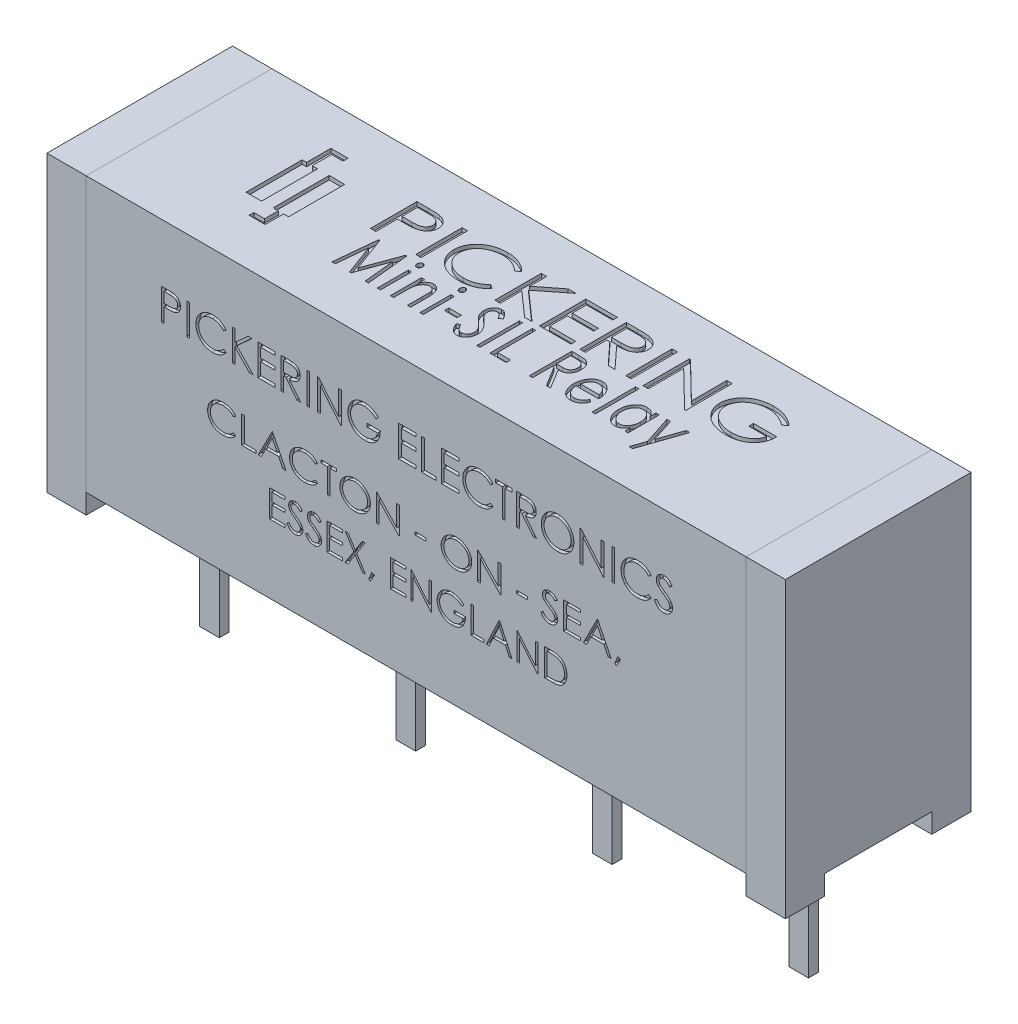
SolidWorks part; units mm, degrees
ref_plane "Front Plane" through (0, 0, 0) normal (0, 0, 1) x (1, 0, 0)
ref_plane "Top Plane" through (0, 0, 0) normal (0, 1, 0) x (1, 0, 0)
ref_plane "Right Plane" through (0, 0, 0) normal (1, 0, 0) x (0, 0, -1)
sketch "Sketch1" plane through (0, 0, 0) normal (0, 1, 0) x (1, 0, 0)
  line L1 (8.534, -2.4) -> (-8.534, -2.4)
  line L2 (8.534, -2.4) -> (8.534, 2.4)
  line L3 (8.534, 2.4) -> (-8.534, 2.4)
  line L4 (-8.534, -2.4) -> (-8.534, 2.4)
  line L5 (8.534, -2.4) -> (-8.534, 2.4) construction
  line L6 (8.534, 2.4) -> (-8.534, -2.4) construction
  point P0 (0, 0)
  dimension "D1" = 4.8
  dimension "D2" = 17.068
extrude "main box" add sketch "Sketch1" along normal blind 7.092
sketch "Sketch2" plane through (-8.534, 0, 0) normal (-1, 0, 0) x (0, 0, 1)
  line L0 (-2.4, 7.092) -> (2.4, 7.092)
  line L1 (2.4, 7.092) -> (2.4, -0.508)
  line L2 (2.4, -0.508) -> (-2.4, -0.508)
  line L3 (-2.4, -0.508) -> (-2.4, 7.092)
  dimension "D1" = 7.6
extrude "end section plus feet" add sketch "Sketch2" along normal blind 1.016 separate body
sketch "Sketch4" plane through (0, 0, 0) normal (0, -1, 0) x (1, 0, 0)
  line L1 (-7.874, -0.127) -> (-7.366, -0.127)
  line L2 (-7.874, -0.127) -> (-7.874, 0.127)
  line L3 (-7.874, 0.127) -> (-7.366, 0.127)
  line L4 (-7.366, -0.127) -> (-7.366, 0.127)
  line L5 (-7.874, -0.127) -> (-7.366, 0.127) construction
  line L6 (-7.874, 0.127) -> (-7.366, -0.127) construction
  line L13 (-2.286, -0.127) -> (-2.794, -0.127)
  line L14 (-2.286, -0.127) -> (-2.286, 0.127)
  line L15 (-2.286, 0.127) -> (-2.794, 0.127)
  line L16 (-2.794, -0.127) -> (-2.794, 0.127)
  line L17 (-2.286, -0.127) -> (-2.794, 0.127) construction
  line L18 (-2.286, 0.127) -> (-2.794, -0.127) construction
  line L19 (-9.55, 2.4) -> (-9.55, -2.4) construction
  line L20 (2.794, -0.127) -> (2.286, -0.127)
  line L21 (2.794, -0.127) -> (2.794, 0.127)
  line L22 (2.794, 0.127) -> (2.286, 0.127)
  line L23 (2.286, -0.127) -> (2.286, 0.127)
  line L24 (2.794, -0.127) -> (2.286, 0.127) construction
  line L25 (2.794, 0.127) -> (2.286, -0.127) construction
  line L26 (7.874, -0.127) -> (7.366, -0.127)
  line L27 (7.874, -0.127) -> (7.874, 0.127)
  line L28 (7.874, 0.127) -> (7.366, 0.127)
  line L29 (7.366, -0.127) -> (7.366, 0.127)
  line L30 (7.874, -0.127) -> (7.366, 0.127) construction
  line L31 (7.874, 0.127) -> (7.366, -0.127) construction
  point P0 (-7.62, 0)
  point P11 (-2.54, 0)
  point P18 (2.54, 0)
  point P23 (7.62, 0)
  dimension "D1" = 0.254
  dimension "D2" = 0.508
  dimension "D3" = 5.08
  dimension "D5" = 0.254
  dimension "D6" = 0.508
  dimension "D7" = 1.93
  dimension "D10" = 5.08
  dimension "D11" = 0.254
  dimension "D12" = 0.508
  dimension "D13" = 0.254
  dimension "D14" = 0.508
  dimension "D15" = 5.08
extrude "Pins" add sketch "Sketch4" along normal blind 3.808
sketch "Sketch6"
  dimension "D1" = 10.15
  dimension "D2" = 9.25
  dimension "D3" = 5.7
  dimension "D4" = 6.05
  dimension "D5" = 2.3
  dimension "D6" = 1.25
extrude "Top writing" cut sketch "Sketch6" against normal blind 0.1
sketch "Sketch7"
  dimension "D1" = 14
  dimension "D2" = 2.55
  dimension "D3" = 2.3
extrude "Pickering electronics" cut sketch "Sketch7" against normal blind 0.1
sketch "Sketch8"
  dimension "D1" = 11
  dimension "D2" = 4
extrude "Address" cut sketch "Sketch8" against normal blind 0.1
sketch "Sketch9" plane through (0, 7.092, 0) normal (0, 1, 0) x (1, 0, 0)
  line L0 (8.534, 2.4) -> (-8.534, 2.4) construction
  line L1 (-5.4, 0.75) -> (-5, 0.75)
  line L2 (-5.4, 0.75) -> (-5.4, -0.7)
  line L3 (-5.4, -0.7) -> (-5.2668, -0.7)
  line L4 (-5, 0.75) -> (-5, -0.7)
  line L5 (-9.55, -2.4) -> (-9.55, 2.4) construction
  line L6 (-5.7, 0.75) -> (-5.8385, 0.75)
  line L7 (-5.7, 0.75) -> (-5.7, -0.7)
  line L8 (-5.7, -0.7) -> (-6.1, -0.7)
  line L9 (-6.1, 0.75) -> (-6.1, -0.7)
  line L10 (-5.9858, 0.75) -> (-6.1, 0.75)
  line L11 (-5.1282, -0.7) -> (-5, -0.7)
  line L12 (-5.9858, 0.75) -> (-5.9858, 1.3793)
  line L13 (-5.9858, 1.3793) -> (-5.8385, 1.3793)
  line L14 (-5.8385, 0.75) -> (-5.8385, 1.2494)
  line L15 (-5.8385, 1.3793) -> (-5.544, 1.3793)
  line L17 (-5.8385, 1.2494) -> (-5.544, 1.2494)
  line L18 (-5.544, 1.3793) -> (-5.544, 1.2494)
  line L20 (-5.1282, -0.7) -> (-5.1282, -1.176)
  line L21 (-5.1282, -1.176) -> (-5.2668, -1.176)
  line L22 (-5.2668, -0.7) -> (-5.2668, -1.0548)
  line L23 (-5.2668, -1.176) -> (-5.544, -1.176)
  line L25 (-5.2668, -1.0548) -> (-5.544, -1.0548)
  line L26 (-5.544, -1.176) -> (-5.544, -1.0548)
  dimension "D1" = 1.65
  dimension "D2" = 1.45
  dimension "D3" = 0.4
  dimension "D4" = 0.4
  dimension "D5" = 0.3
  dimension "D6" = 3.45
extrude "Pickering logo" cut sketch "Sketch9" against normal blind 0.1
sketch "Sketch10"
  dimension "D1" = 3.4
  dimension "D2" = 4
  dimension "D3" = 11.5
extrude "Extrude7" add sketch "Sketch10" along normal blind 0.0001
sketch "Sketch11" plane through (8.534, 0, 0) normal (1, 0, 0) x (0, 0, -1)
  line L1 (-2.4, 7.092) -> (2.4, 7.092)
  line L2 (-2.4, 7.092) -> (-2.4, -0.508)
  line L3 (-2.4, -0.508) -> (2.4, -0.508)
  line L4 (2.4, 7.092) -> (2.4, -0.508)
extrude "Extrude8" add sketch "Sketch11" along normal blind 1.016 separate body
sketch "Sketch12" plane through (-9.55, 0, 0) normal (-1, 0, 0) x (0, 0, 1)
  line L0 (-2.4, -0.508) -> (2.4, -0.508) construction
  line L1 (-1.384, -0.508) -> (1.384, -0.508)
  line L2 (-1.384, -0.508) -> (-1.384, 0)
  line L3 (-1.384, 0) -> (1.384, 0)
  line L4 (1.384, -0.508) -> (1.384, 0)
  line L5 (2.4, -0.508) -> (2.4, 7.092) construction
  dimension "D1" = 0.508
  dimension "D2" = 2.768
  dimension "D3" = 1.016
extrude "Extrude9" cut sketch "Sketch12" against normal blind 1.016
sketch "Sketch13" plane through (9.55, 0, 0) normal (1, 0, 0) x (0, 0, -1)
  line L0 (-2.4, -0.508) -> (2.4, -0.508) construction
  line L1 (-1.384, -0.508) -> (1.384, -0.508)
  line L2 (-1.384, -0.508) -> (-1.384, 0)
  line L3 (-1.384, 0) -> (1.384, 0)
  line L4 (1.384, -0.508) -> (1.384, 0)
  line L6 (2.4, -0.508) -> (2.4, 7.092) construction
  dimension "D1" = 0.508
  dimension "D2" = 2.768
  dimension "D3" = 1.016
extrude "Extrude10" cut sketch "Sketch13" against normal blind 1.016
